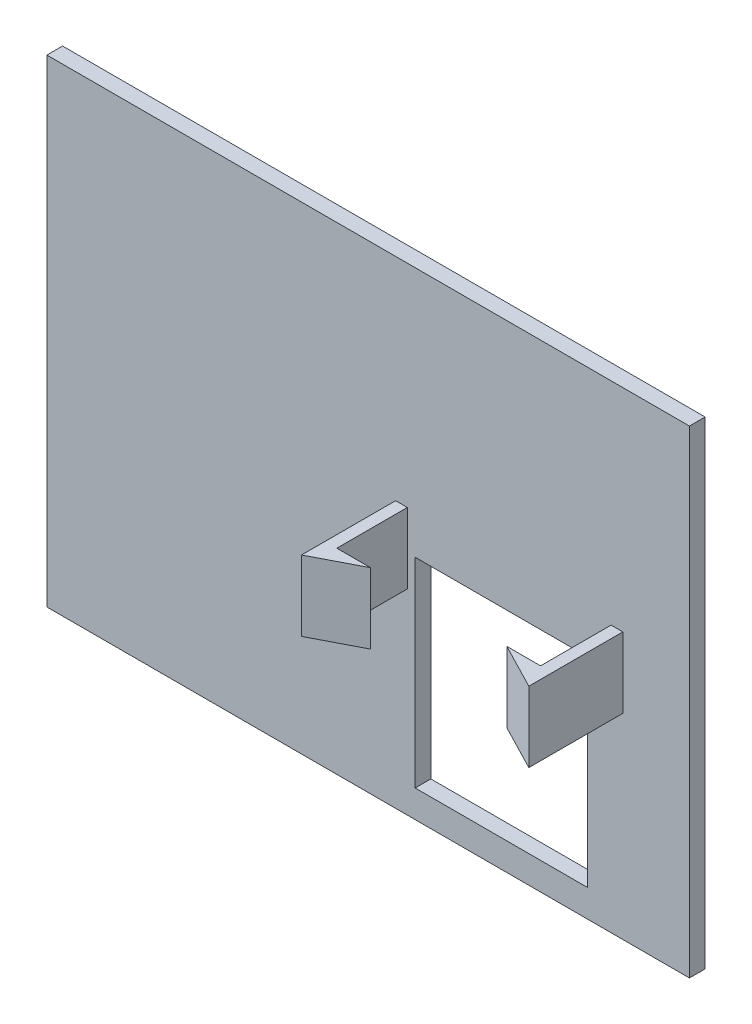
SolidWorks part; units mm, degrees
ref_plane "Alzado" through (0, 0, 0) normal (0, 0, 1) x (1, 0, 0)
ref_plane "Planta" through (0, 0, 0) normal (0, 1, 0) x (1, 0, 0)
ref_plane "Vista lateral" through (0, 0, 0) normal (1, 0, 0) x (0, 0, -1)
sketch "Croquis1" plane through (0, 0, 0) normal (0, 0, 1) x (1, 0, 0)
  line L1 (-47.3837, 38.4675) -> (34.6163, 38.4675)
  line L2 (-47.3837, 38.4675) -> (-47.3837, -22.5325)
  line L3 (-47.3837, -22.5325) -> (34.6163, -22.5325)
  line L4 (34.6163, 38.4675) -> (34.6163, -22.5325)
  dimension "D1" = 61
  dimension "D2" = 82
extrude "Saliente-Extruir1" add sketch "Croquis1" along normal blind 2
sketch "Croquis2" plane through (0, 0, 0) normal (0, 0, -1) x (-1, 0, 0)
  line L0 (-24.6163, 38.4675) -> (-24.6163, -21.7089) construction
  line L1 (-34.6163, 38.4675) -> (47.3837, 38.4675) construction
  line L2 (-34.6163, -22.5325) -> (-34.6163, 38.4675) construction
  line L3 (-34.6163, 18.4675) -> (48.5779, 18.4675) construction
  line L4 (-34.6163, -20.5325) -> (45.4592, -20.5325) construction
  line L5 (47.3837, -22.5325) -> (-34.6163, -22.5325) construction
  line L6 (1.3837, -20.5325) -> (1.3837, 18.4675) construction
  line L7 (-24.6163, -19.0325) -> (1.3837, -19.0325) construction
  line L8 (0.3837, -20.5325) -> (0.3837, -12.2308) construction
  line L9 (0.3837, 6.4675) -> (-24.6163, 6.4675) construction
  line L10 (-21.6163, -19.0325) -> (-21.6163, 6.4675) construction
  line L11 (0.3837, -19.0325) -> (-21.6163, -19.0325)
  line L12 (0.3837, -19.0325) -> (0.3837, 6.4675)
  line L13 (-21.6163, -19.0325) -> (-21.6163, 6.4675)
  line L14 (0.3837, 6.4675) -> (-21.6163, 6.4675)
  point P17 (0.3837, -19.0325)
  dimension "D1" = 10
  dimension "D2" = 2
  dimension "D3" = 39
  dimension "D4" = 26
  dimension "D5" = 1.5
  dimension "D6" = 1
  dimension "D7" = 25.5
  dimension "D8" = 22
extrude "Cortar-Extruir1" cut sketch "Croquis2" against normal blind 2
sketch "Croquis8" plane through (0, 0, 0) normal (0, 0, -1) x (-1, 0, 0)
  line L0 (-24.6163, -22.5325) -> (-24.6163, 16.4675) construction
  line L1 (47.3837, -22.5325) -> (-34.6163, -22.5325) construction
  line L2 (-24.6163, 16.4675) -> (1.3837, 16.4675) construction
  line L3 (1.3837, 16.4675) -> (1.3837, -22.5325) construction
  line L4 (-34.6163, -22.5325) -> (-34.6163, 38.4675) construction
  line L5 (0.3837, -19.0325) -> (0.3837, 6.4675) construction
  line L6 (-34.6163, -20.5325) -> (8.9705, -20.5325) construction
  line L7 (-24.6163, 11.4675) -> (1.3837, 11.4675) construction
  line L8 (-24.6163, 2.4675) -> (1.3837, 2.4675) construction
  line L10 (-24.6163, 2.4675) -> (-26.1163, 2.4675)
  line L11 (-24.6163, 2.4675) -> (-24.6163, 11.4675)
  line L12 (-24.6163, 11.4675) -> (-26.1163, 11.4675)
  line L13 (-26.1163, 2.4675) -> (-26.1163, 11.4675)
  line L14 (1.3837, 2.4675) -> (2.8837, 2.4675)
  line L15 (1.3837, 2.4675) -> (1.3837, 11.4675)
  line L16 (1.3837, 11.4675) -> (2.8837, 11.4675)
  line L17 (2.8837, 2.4675) -> (2.8837, 11.4675)
  dimension "D1" = 10
  dimension "D2" = 39
  dimension "D3" = 1
  dimension "D4" = 2
  dimension "D5" = 5
  dimension "D6" = 14
  dimension "D7" = 9
  dimension "D8" = 1.5
  dimension "D9" = 9
  dimension "D10" = 1.5
extrude "Saliente-Extruir2" add sketch "Croquis8" against normal blind 14
sketch "Croquis9" plane through (0, 0, 14) normal (0, 0, 1) x (1, 0, 0)
  line L4 (26.1163, 2.4675) -> (24.6163, 11.4675) construction
  line L5 (24.6163, 11.4675) -> (26.1163, 11.4675) construction
  line L6 (24.6163, 2.4675) -> (24.6163, 11.4675) construction
  line L7 (24.6163, 11.4675) -> (26.1163, 11.4675) construction
  line L8 (-1.3837, 2.4675) -> (-2.8837, 2.4675) construction
  line L9 (-2.8837, 2.4675) -> (-2.8837, 11.4675) construction
  line L10 (-2.8837, 11.4675) -> (-1.3837, 2.4675) construction
  line L11 (-1.3837, 2.4675) -> (-1.3837, 11.4675) construction
  line L12 (-1.3837, 11.4675) -> (-2.8837, 2.4675) construction
  line L13 (-2.1337, 6.9675) -> (-2.1337, 11.4675) construction
  line L15 (-1.3837, 11.4675) -> (-1.3837, 2.4675)
  line L16 (-1.3837, 2.4675) -> (2.9163, 2.4675)
  line L17 (-1.3837, 11.4675) -> (2.9163, 11.4675)
  line L18 (2.9163, 11.4675) -> (2.9163, 2.4675)
  line L19 (24.6163, 2.4675) -> (26.1163, 11.4675) construction
  line L20 (25.3663, 2.4675) -> (25.3663, 11.4675) construction
  line L21 (24.6163, 11.4675) -> (24.6163, 2.4675)
  line L22 (24.6163, 2.4675) -> (20.3163, 2.4675)
  line L23 (20.3163, 11.4675) -> (20.3163, 2.4675)
  line L24 (24.6163, 11.4675) -> (20.3163, 11.4675)
  point P17 (-2.1337, 6.9675)
  point P30 (25.3663, 6.9675)
extrude "Saliente-Extruir3" add sketch "Croquis9" against normal blind 3
sketch "Croquis10" plane through (0, 2.4675, 0) normal (0, -1, 0) x (1, 0, 0)
  line L0 (-2.8837, 14) -> (2.9163, 11)
  line L1 (2.9163, 11) -> (2.9163, 14)
  line L2 (2.9163, 14) -> (-2.8837, 14)
  line L3 (20.3163, 11) -> (26.1163, 14)
  line L4 (26.1163, 14) -> (20.3163, 14) construction
  line L5 (26.1163, 14) -> (26.1163, 2) construction
  line L6 (26.1163, 14) -> (20.3163, 14)
  line L7 (20.3163, 14) -> (20.3163, 11)
extrude "Cortar-Extruir2" cut sketch "Croquis10" against normal blind 10
sketch "Croquis11" plane through (0, 0, 0) normal (0, 0, -1) x (-1, 0, 0)
  line L0 (25.4224, -21.5325) -> (25.4224, 38.4675) construction
  line L2 (-34.6163, 38.4675) -> (47.3837, 38.4675) construction
  line L3 (47.3837, -21.5325) -> (25.4224, -21.5325) construction
  line L4 (47.3837, 38.4675) -> (47.3837, -22.5325) construction
  line L5 (47.3837, -22.5325) -> (-34.6163, -22.5325) construction
  line L6 (38.3837, -21.5325) -> (38.3837, 38.4675) construction
  line L7 (43.3837, -21.5325) -> (43.3837, 38.4675) construction
  text T0 "<b>Modulo  NDVI</b>" font "Century Gothic" height 6.4
  text T1 "Barreiros J." font "Century Gothic" height 4
  text T2 "Magne N." font "Century Gothic" height 4
  dimension "D1" = 1
  dimension "D2" = 4
  dimension "D3" = 9
extrude "Saliente-Extruir4" add sketch "Croquis11" along normal blind 1
sketch "Croquis12" [suppressed] plane through (0, 0, 0) normal (0, 0, -1) x (-1, 0, 0)
  line L0 (-34.6163, -22.5325) -> (-34.6163, 38.4675) construction
  line L2 (47.3837, -22.5325) -> (-34.6163, -22.5325) construction
  line L3 (-34.6163, 38.4675) -> (47.3837, 38.4675) construction
  line L4 (47.3837, 38.4675) -> (47.3837, -22.5325) construction
  circle A0 centre (-32.6163, -20.5325) radius 1
  circle A1 centre (-32.6163, 36.4675) radius 1
  circle A2 centre (45.3837, -20.5325) radius 1
  circle A3 centre (45.3837, 36.4675) radius 1
  dimension "D1" = 2
  dimension "D3" = 2
  dimension "D4" = 2
  dimension "D7" = 2
  dimension "D9" = 2
  dimension "D2" = 2
  dimension "D5" = 2
  dimension "D6" = 2
  dimension "D8" = 2
extrude "Cortar-Extruir3" [suppressed] cut sketch "Croquis12" against normal blind 10
